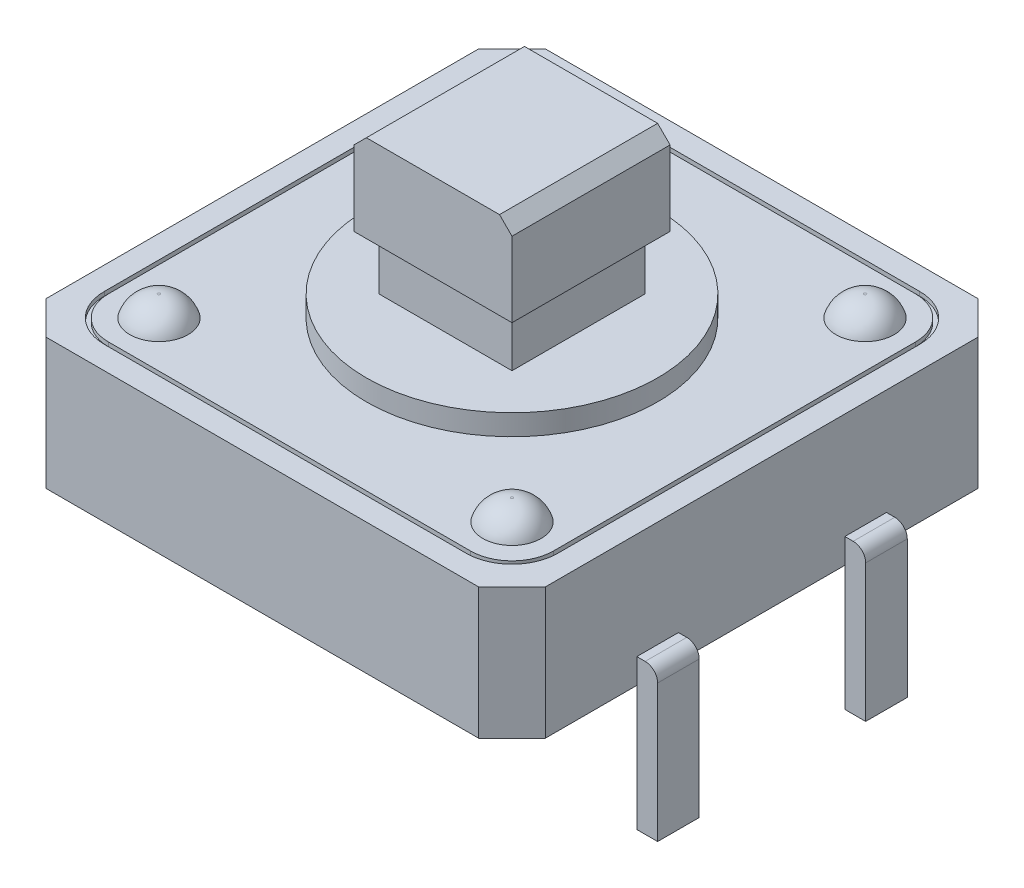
SolidWorks part; units mm, degrees
ref_plane "Спереди" through (0, 0, 0) normal (0, 0, 1) x (1, 0, 0)
ref_plane "Сверху" through (0, 0, 0) normal (0, 1, 0) x (1, 0, 0)
ref_plane "Справа" through (0, 0, 0) normal (1, 0, 0) x (0, 0, -1)
sketch "Эскиз1" plane through (0, 0, 0) normal (0, 1, 0) x (1, 0, 0)
  line L1 (-6, -6) -> (6, -6)
  line L2 (-6, -6) -> (-6, 6)
  line L3 (-6, 6) -> (6, 6)
  line L4 (6, -6) -> (6, 6)
  line L5 (-6, -6) -> (6, 6) construction
  line L6 (-6, 6) -> (6, -6) construction
  point P0 (0, 0)
  dimension "D1" = 12
  dimension "D2" = 12
extrude "Бобышка-Вытянуть1" add sketch "Эскиз1" along normal blind 3.15
chamfer "Фаска1" distance 0.8 angle 45 4 edges at (-6, 1.575, -6) (-6, 1.575, 6) (6, 1.575, -6) (6, 1.575, 6)
sketch "Эскиз2" plane through (6, 0, 0) normal (1, 0, 0) x (0, 0, -1)
  line L4 (-3, -3) -> (-2, -3)
  line L5 (-3, -3) -> (-3, 0.6)
  line L6 (-3, 0.6) -> (-2, 0.6)
  line L7 (-2, -3) -> (-2, 0.6)
  line L8 (-3, -3) -> (-2, 0.6) construction
  line L9 (-3, 0.6) -> (-2, -3) construction
  line L10 (2, -3) -> (3, -3)
  line L11 (2, -3) -> (2, 0.6)
  line L12 (2, 0.6) -> (3, 0.6)
  line L13 (3, -3) -> (3, 0.6)
  line L14 (2, -3) -> (3, 0.6) construction
  line L15 (2, 0.6) -> (3, -3) construction
  point P6 (-2.5, -1.2)
  point P11 (2.5, -1.2)
  dimension "D1" = 3.6
  dimension "D2" = 1
  dimension "D3" = 1
  dimension "D4" = 3.6
extrude "Бобышка-Вытянуть2" add sketch "Эскиз2" along normal blind 0.5
sketch "Эскиз5" plane through (-6, 0, 0) normal (-1, 0, 0) x (0, 0, 1)
  line L2 (-3, -3) -> (-2, -3)
  line L3 (-3, -3) -> (-3, 0.6)
  line L4 (-3, 0.6) -> (-2, 0.6)
  line L5 (-2, -3) -> (-2, 0.6)
  line L6 (-3, -3) -> (-2, 0.6) construction
  line L7 (-3, 0.6) -> (-2, -3) construction
  line L8 (2, -3) -> (3, -3)
  line L9 (2, -3) -> (2, 0.6)
  line L10 (2, 0.6) -> (3, 0.6)
  line L11 (3, -3) -> (3, 0.6)
  line L12 (2, -3) -> (3, 0.6) construction
  line L13 (2, 0.6) -> (3, -3) construction
  point P3 (-2.5, -1.2)
  point P8 (2.5, -1.2)
  dimension "D1" = 3.6
  dimension "D2" = 3.6
extrude "Бобышка-Вытянуть3" add sketch "Эскиз5" along normal blind 0.5
sketch "Эскиз6" plane through (0, 3.15, 0) normal (0, 1, 0) x (1, 0, 0)
  circle A0 centre (0, 0) radius 3.5
  circle A2 centre (-4.2426, -4.2426) radius 0.7
  circle A3 centre (4.2426, 4.2426) radius 0.7
  circle A4 centre (-4.2426, 4.2426) radius 0.7
  circle A5 centre (4.2426, -4.2426) radius 0.7
extrude "Бобышка-Вытянуть4" add sketch "Эскиз6" along normal blind 0.5
fillet "Скругление1" radius 0.7 4 edges at (4.2426, 3.65, 4.9426) (4.2426, 3.65, -3.5426) (-4.2426, 3.65, -3.5426) (-4.2426, 3.65, 4.9426)
sketch "Эскиз8" plane through (0, 0, 0) normal (0, -1, 0) x (1, 0, 0)
  line L7 (-5, 5) -> (-2.5, 5)
  line L8 (-5, 5) -> (-5, 2.5)
  line L9 (-5, 2.5) -> (-2.5, 2.5)
  line L10 (-2.5, 5) -> (-2.5, 2.5)
  line L11 (-5, -5) -> (-2.5, -5)
  line L12 (-5, -5) -> (-5, -2.5)
  line L13 (-5, -2.5) -> (-2.5, -2.5)
  line L14 (-2.5, -5) -> (-2.5, -2.5)
  line L15 (5, 5) -> (2.5, 5)
  line L16 (5, 5) -> (5, 2.5)
  line L17 (5, 2.5) -> (2.5, 2.5)
  line L18 (2.5, 5) -> (2.5, 2.5)
  line L19 (5, -5) -> (2.5, -5)
  line L20 (5, -5) -> (5, -2.5)
  line L21 (5, -2.5) -> (2.5, -2.5)
  line L22 (2.5, -5) -> (2.5, -2.5)
  point P0 (0, 0)
  dimension "D1" = 10
  dimension "D2" = 10
  dimension "D3" = 2.5
  dimension "D4" = 2.5
  dimension "D5" = 2.5
  dimension "D6" = 2.5
extrude "Бобышка-Вытянуть5" add sketch "Эскиз8" along normal blind 0.35
chamfer "Фаска2" distance 0.3 angle 45 3 edges at (5, -0.175, -5) (5, -0.175, 5) (-5, -0.175, 5)
sketch "Эскиз9" plane through (0, 3.65, 0) normal (0, 1, 0) x (1, 0, 0)
  line L1 (-1.6, -1.6) -> (1.6, -1.6)
  line L2 (-1.6, -1.6) -> (-1.6, 1.6)
  line L3 (-1.6, 1.6) -> (1.6, 1.6)
  line L4 (1.6, -1.6) -> (1.6, 1.6)
  line L5 (-1.6, -1.6) -> (1.6, 1.6) construction
  line L6 (-1.6, 1.6) -> (1.6, -1.6) construction
  point P0 (0, 0)
  dimension "D1" = 3.2
  dimension "D2" = 3.2
extrude "Бобышка-Вытянуть6" add sketch "Эскиз9" along normal blind 1.3
sketch "Эскиз10" plane through (0, 4.95, 0) normal (0, 1, 0) x (1, 0, 0)
  line L1 (-1.9, -1.9) -> (1.9, -1.9)
  line L2 (-1.9, -1.9) -> (-1.9, 1.9)
  line L3 (-1.9, 1.9) -> (1.9, 1.9)
  line L4 (1.9, -1.9) -> (1.9, 1.9)
  line L5 (-1.9, -1.9) -> (1.9, 1.9) construction
  line L6 (-1.9, 1.9) -> (1.9, -1.9) construction
  point P0 (0, 0)
  dimension "D1" = 3.8
  dimension "D2" = 3.8
extrude "Бобышка-Вытянуть7" add sketch "Эскиз10" along normal blind 2.1
sketch "Эскиз12" plane through (0, 3.15, 0) normal (0, 1, 0) x (1, 0, 0)
  line L1 (-4.35, -5.35) -> (4.35, -5.35)
  line L2 (-5.35, -4.35) -> (-5.35, 4.35)
  line L3 (-4.35, 5.35) -> (4.35, 5.35)
  line L4 (5.35, -4.35) -> (5.35, 4.35)
  line L5 (-5.35, -5.35) -> (5.35, 5.35) construction
  line L6 (-5.35, 5.35) -> (5.35, -5.35) construction
  line L7 (-4.35, -5.45) -> (4.35, -5.45)
  line L8 (-5.45, -4.35) -> (-5.45, 4.35)
  line L9 (-4.35, 5.45) -> (4.35, 5.45)
  line L10 (5.45, -4.35) -> (5.45, 4.35)
  line L11 (-5.45, -5.45) -> (5.45, 5.45) construction
  line L12 (-5.45, 5.45) -> (5.45, -5.45) construction
  arc A0 (-5.35, -4.35) -> (-4.35, -5.35) centre (-4.35, -4.35) ccw
  arc A1 (4.35, -5.35) -> (5.35, -4.35) centre (4.35, -4.35) ccw
  arc A2 (5.35, 4.35) -> (4.35, 5.35) centre (4.35, 4.35) ccw
  arc A3 (-4.35, 5.35) -> (-5.35, 4.35) centre (-4.35, 4.35) ccw
  arc A4 (5.45, -4.35) -> (4.35, -5.45) centre (4.35, -4.35) cw
  arc A5 (-4.35, -5.45) -> (-5.45, -4.35) centre (-4.35, -4.35) cw
  arc A6 (5.45, 4.35) -> (4.35, 5.45) centre (4.35, 4.35) ccw
  arc A7 (-4.35, 5.45) -> (-5.45, 4.35) centre (-4.35, 4.35) ccw
  point P0 (0, 0)
  point P18 (0, 0)
  dimension "D3" = 1
  dimension "D6" = 1.1
  dimension "D1" = 10.7
  dimension "D2" = 10.7
  dimension "D4" = 10.9
  dimension "D5" = 10.9
extrude "Вырез-Вытянуть1" cut sketch "Эскиз12" against normal blind 0.1
chamfer "Фаска3" distance 0.3 angle 45 2 edges at (1.9, 7.05, 0) (-1.9, 7.05, 0)
fillet "Скругление2" radius 0.3 4 edges at (6.5, 0.6, -2.5) (6.5, 0.6, 2.5) (-6.5, 0.6, 2.5) (-6.5, 0.6, -2.5)
